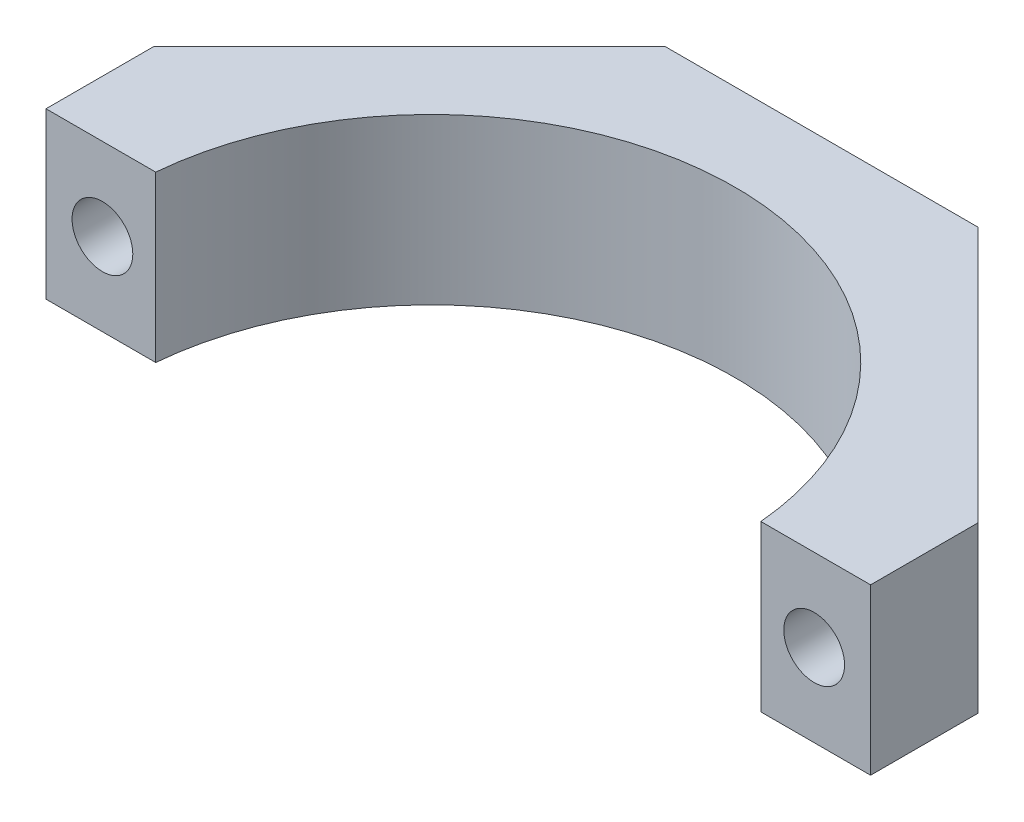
SolidWorks part; units mm, degrees
ref_plane "Front Plane" through (0, 0, 0) normal (0, 0, 1) x (1, 0, 0)
ref_plane "Top Plane" through (0, 0, 0) normal (0, 1, 0) x (1, 0, 0)
ref_plane "Right Plane" through (0, 0, 0) normal (1, 0, 0) x (0, 0, -1)
sketch "Sketch1" plane through (0, 0, 0) normal (0, 1, 0) x (1, 0, 0)
  line L0 (0, 0) -> (0, 7.874)
  line L1 (0, 0) -> (6.35, 0)
  line L2 (48.26, 0) -> (48.26, 7.874)
  line L3 (14.986, 22.86) -> (0, 7.874)
  line L4 (41.91, 0) -> (48.26, 0)
  line L5 (33.274, 22.86) -> (48.26, 7.874)
  line L6 (24.13, 17.78) -> (24.13, 22.86) construction
  line L7 (33.274, 22.86) -> (14.986, 22.86)
  arc A0 (41.91, 0) -> (6.35, 0) centre (24.13, 0) ccw
  dimension "D1" = 7.874
extrude "Extrude1" add sketch "Sketch1" along normal blind 9.652
ref_plane "Plane1" through (0, 0, -7.874) normal (0, 0, 1) x (1, 0, 0)
sketch "Sketch2" plane through (0, 0, -7.874) normal (0, 0, 1) x (1, 0, 0)
  circle A0 centre (3.302, 4.826) radius 1.778
  circle A1 centre (44.958, 4.826) radius 1.778
extrude "Cut-Extrude1" cut sketch "Sketch2" against normal through all and the other way through all
sketch "Sketch3" plane through (0, 0, -7.874) normal (0, 0, 1) x (1, 0, 0)
  circle A0 centre (3.302, 4.826) radius 3.175
  circle A1 centre (44.958, 4.826) radius 3.175
extrude "Cut-Extrude2" cut sketch "Sketch3" against normal through all
sketch "Sketch4" plane through (0, 0, 0) normal (0, 0, 1) x (1, 0, 0)
  line L1 (-1.1866, 12.5376) -> (49.4466, 12.5376)
  line L2 (-1.1866, 12.5376) -> (-1.1866, -4.0214)
  line L3 (-1.1866, -4.0214) -> (49.4466, -4.0214)
  line L4 (49.4466, 12.5376) -> (49.4466, -4.0214)
extrude "Cut-Extrude3" cut sketch "Sketch4" against normal blind 1.5875
